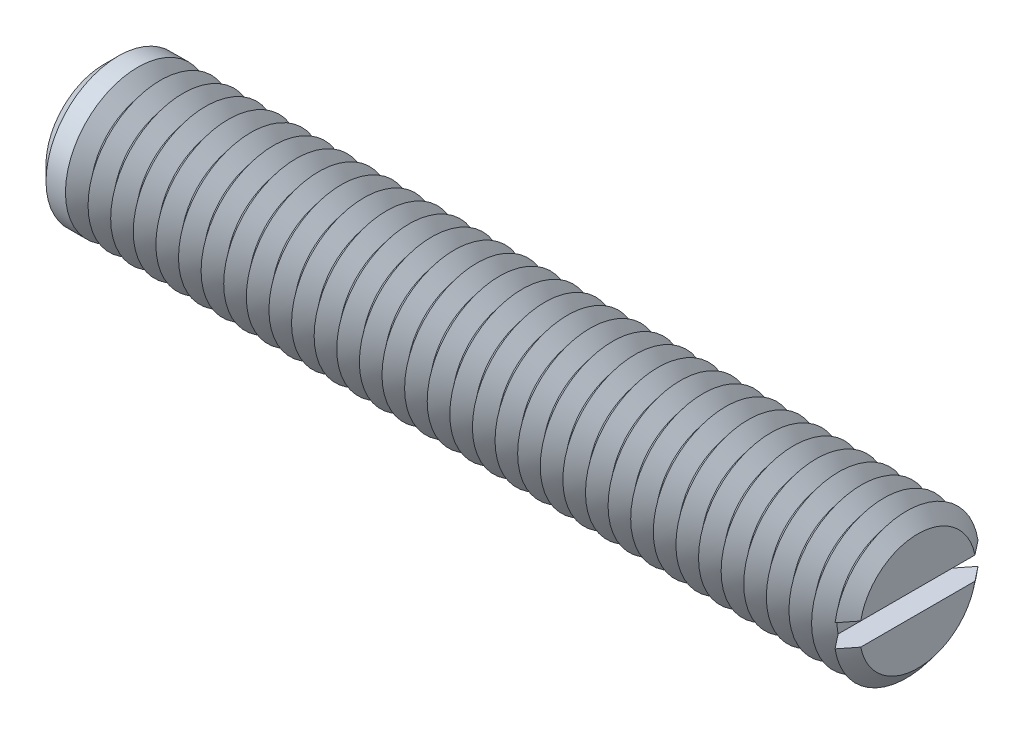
SolidWorks part; units mm, degrees
ref_plane "Front Plane" through (0, 0, 0) normal (0, 0, 1) x (1, 0, 0)
ref_plane "Top Plane" through (0, 0, 0) normal (0, 1, 0) x (1, 0, 0)
ref_plane "Right Plane" through (0, 0, 0) normal (1, 0, 0) x (0, 0, -1)
sketch "Sketch1" plane through (0, 0, 0) normal (1, 0, 0) x (0, 0, -1)
  circle A0 centre (0, 0) radius 4
  dimension "D1" = 8
extrude "Extrude1" add sketch "Sketch1" along normal mid plane 45
sketch "Sketch2" plane through (0, 0, 0) normal (0, 0, 1) x (1, 0, 0)
  line L0 (22.5, 0.625) -> (21.25, 0.625)
  line L1 (22.5, -4) -> (22.5, 4) construction
  line L2 (21.25, 0.625) -> (21.25, -0.625)
  line L3 (0, 0) -> (50000, 0) construction
  line L4 (22.5, -0.625) -> (21.25, -0.625)
  line L5 (22.5, -0.625) -> (22.5, 0.625)
  point P9 (21.25, 0)
  dimension "D1" = 1.25
extrude "Extrude2" cut sketch "Sketch2" against normal mid plane 12
chamfer "Chamfer1" distance 0.8 angle 45 1 edges at (-22.5, 0, -4)
sketch "Sketch3" plane through (0, 0, 0) normal (0, 0, 1) x (1, 0, 0)
  line L0 (0, 0) -> (30.9602, 0) construction
  line L1 (21.875, -4) -> (23.125, -4)
  line L2 (-21.7, -4) -> (22.5, -4) construction
  line L3 (23.125, -4) -> (22.5, -3.2194)
  line L4 (22.5, -4) -> (22.5, -0.625) construction
  line L5 (22.5, -3.2194) -> (21.875, -4)
  dimension "D1" = 1.25
  dimension "D2" = 1
revolve "Cut-Revolve1" cut sketch "Sketch3" angle 360 about L0
pattern_linear "LPattern1" count 35 spacing 1.25 along (-1, 0, 0) of "Cut-Revolve1"
equation "\"D2@Sketch3\" = \"D1@Sketch3\"*0.8"
